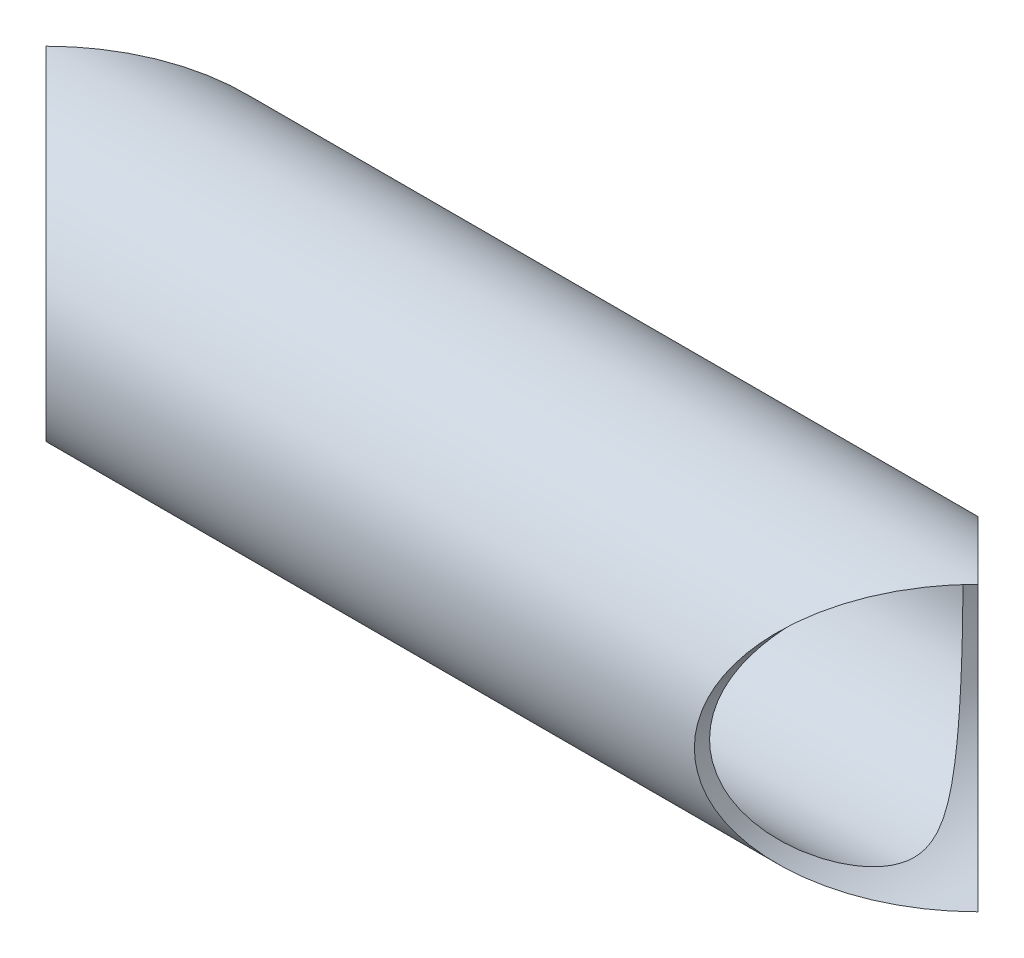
SolidWorks part; units mm, degrees
ref_plane "Plan1" through (0, 0, 0) normal (0, 0, 1) x (1, 0, 0)
ref_plane "Plan2" through (0, 0, 0) normal (0, 1, 0) x (1, 0, 0)
ref_plane "Plan3" through (0, 0, 0) normal (1, 0, 0) x (0, 0, -1)
ref_plane "Plan4" through (-241, 0, 0) normal (1, 0, 0) x (0, 0, -1)
sketch "Esquisse2" plane through (-241, 0, 0) normal (1, 0, 0) x (0, 0, -1)
  line L0 (1230, 14) -> (603.7337, 14) construction
  line L1 (999, 108) -> (999, 8.6603) construction
  circle A0 centre (989, 0) radius 14
  circle A1 centre (989, 0) radius 12.5
  dimension "D1" = 28
  dimension "D2" = 10
  dimension "D3" = 1.5
extrude "Base-Extrusion" add sketch "Esquisse2" along normal up to surface (30 mm away)
sketch "Esquisse4" plane through (-241, 0, 0) normal (1, 0, 0) x (0, 0, -1)
  circle A0 centre (989, 0) radius 12.5 construction
  circle A1 centre (989, 0) radius 14
  circle A2 centre (989, 0) radius 14
  circle A3 centre (989, 0) radius 12.5
  dimension "D1" = 0
extrude "Boss.-Extru.2" add sketch "Esquisse4" along normal up to surface (34 mm away)
